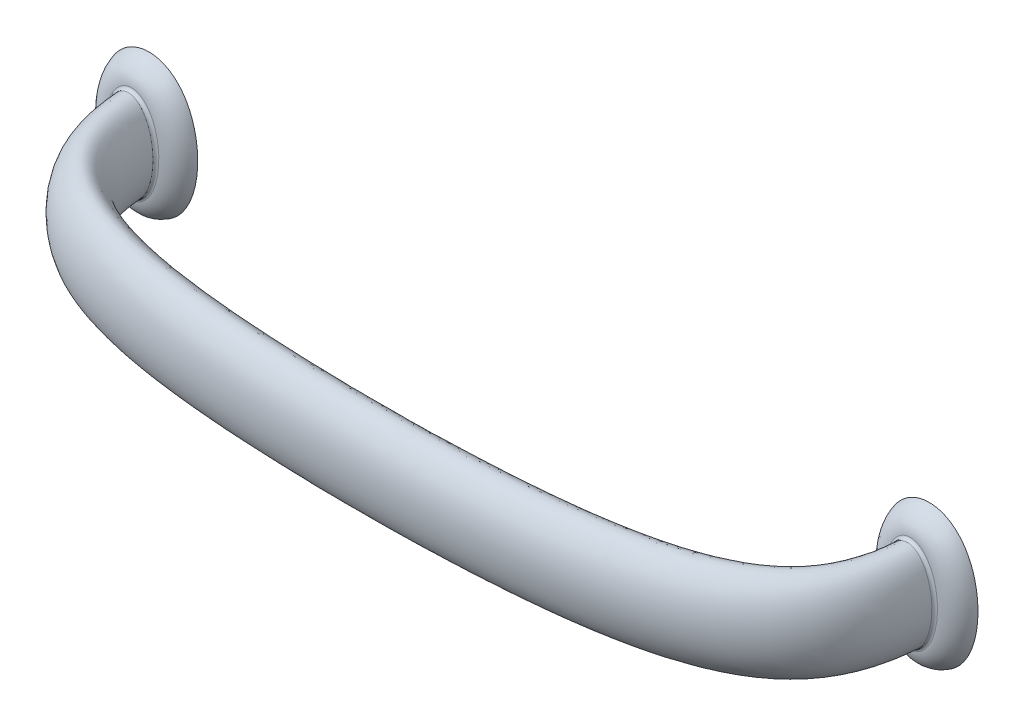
SolidWorks part; units mm, degrees
ref_plane "Front Plane" through (0, 0, 0) normal (0, 0, 1) x (1, 0, 0)
ref_plane "Top Plane" through (0, 0, 0) normal (0, 1, 0) x (1, 0, 0)
ref_plane "Right Plane" through (0, 0, 0) normal (1, 0, 0) x (0, 0, -1)
sketch "Sketch1" plane through (0, 0, 0) normal (0, 1, 0) x (1, 0, 0)
  line L0 (-64, 0) -> (64, 0) construction
  line L1 (0, 0) -> (0, -28) construction
  line L2 (-64, 0) -> (-64, -33.6) construction
  line L3 (-64, -33.6) -> (-36, -28) construction
  line L4 (64, -33.6) -> (64, 0) construction
  line L5 (-36, -28) -> (36, -28) construction
  line L6 (36, -28) -> (64, -33.6) construction
  spline_without_curve S0
  dimension "D1" = 128
  dimension "D2" = 28
  dimension "D3" = 28
sketch "Sketch2" plane through (0, 0, 0) normal (0, 0, 1) x (1, 0, 0)
  ellipse E0 centre (-64, 0) end of major axis (-64, 7.5) minor radius 4
  dimension "D1" = 15
  dimension "D2" = 8
sweep "Sweep1" add profiles "Sketch2" path "Sketch1"
sketch "Sketch3" plane through (0, 0, 0) normal (0, 0, 1) x (1, 0, 0)
  spline S0 degree 3 number of poles 95 (-64, -11.5) -> (-64, -11.5)
  spline S1 degree 3 number of poles 95 (-64, -11.5) -> (-64, -11.5)
  dimension "D1" = 4
extrude "Boss-Extrude1" add sketch "Sketch3" along normal blind 3
fillet "Fillet1" radius 4 1 edges
fillet "Fillet2" radius 0.5 1 edges at (-63.196, -7.3836, 3)
mirror "Mirror1" about plane through (0, 0, 0) normal (1, 0, 0) of "Boss-Extrude1", "Fillet2", "Fillet1"
